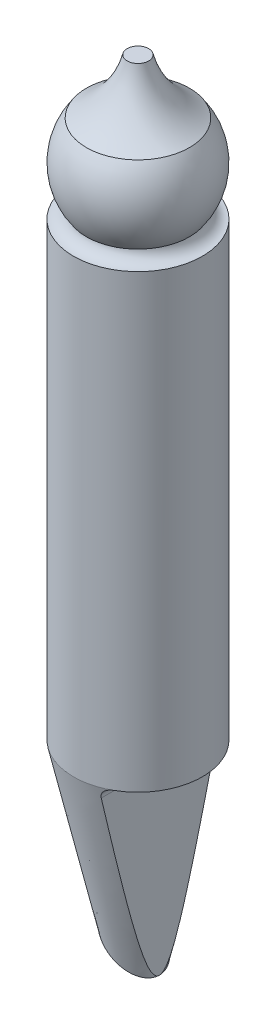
SolidWorks part; units mm, degrees
ref_plane "Front Plane" through (0, 0, 0) normal (0, 0, 1) x (1, 0, 0)
ref_plane "Top Plane" through (0, 0, 0) normal (0, 1, 0) x (1, 0, 0)
ref_plane "Right Plane" through (0, 0, 0) normal (1, 0, 0) x (0, 0, -1)
sketch "Sketch1" plane through (0, 0, 0) normal (0, 0, 1) x (1, 0, 0)
  line L0 (0, 30) -> (0, 0)
  line L1 (3, 30) -> (3, 9)
  line L2 (2.9773, 30) -> (3, 30)
  line L3 (0, 30) -> (3, 30) construction
  line L4 (0, 9) -> (3, 9)
  line L5 (3, 30) -> (3, 0) construction
  line L6 (3, 9) -> (1, 0)
  line L7 (1, 0) -> (0, 0)
  line L8 (0, 0) -> (-0.0162, -0.0215)
  line L15 (0, 30) -> (0, 36.6288)
  line L16 (0, 36.6288) -> (0.5, 36.6288)
  arc A1 (2.4, 30.4839) -> (2.4, 34.0839) centre (0, 32.2839) ccw
  arc A2 (0.5, 36.6288) -> (2.4, 34.0839) centre (4.3919, 37.5526) ccw
  arc A3 (2.4, 30.4839) -> (3, 30) centre (2.9887, 30.5999) ccw
  dimension "D8" = 4
  dimension "D9" = 0.6
  dimension "D1" = 30
  dimension "D4" = 1
  dimension "D7" = 0.5
  dimension "D2" = 3
  dimension "D3" = 21
revolve "Revolve1" add sketch "Sketch1" angle 360 about L0
sketch "Sketch5" plane through (0, 0, 0) normal (0, 0, 1) x (1, 0, 0)
  line L0 (-1, 0) -> (1, 0) construction
  line L1 (1, 0) -> (1, 9)
  line L2 (1, 0) -> (3, 9) construction
  line L3 (1, 0) -> (3, 9)
  line L4 (1, 0) -> (-1.3851, 1.7329)
  line L5 (-3, 9) -> (-1, 0) construction
  line L6 (-1.3851, 1.7329) -> (-1, 0)
  line L7 (-1, 0) -> (1, 0)
  line L8 (3, 9) -> (-3, 9) construction
  line L9 (3, 9) -> (1, 9)
  dimension "D2" = 126
extrude "Cut-Extrude2" cut sketch "Sketch5" against normal through all both and the other way through all contours L3 L9 L1 | L6 L7 L4
fillet "Fillet2" radius 0.5 1 edges at (1, 9, 0)
